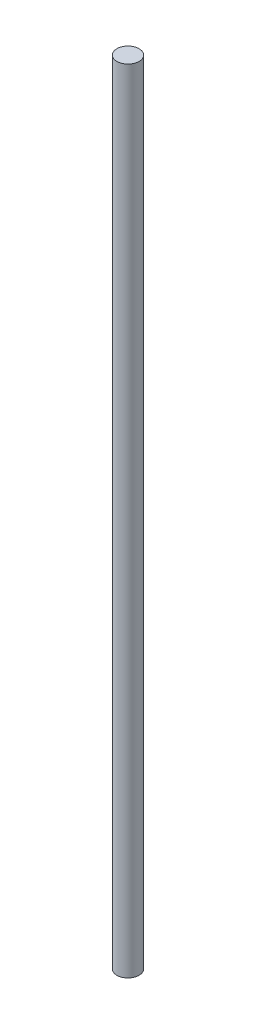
SolidWorks part; units mm, degrees
ref_plane "Alzado" through (0, 0, 0) normal (0, 0, 1) x (1, 0, 0)
ref_plane "Planta" through (0, 0, 0) normal (0, 1, 0) x (1, 0, 0)
ref_plane "Vista lateral" through (0, 0, 0) normal (1, 0, 0) x (0, 0, -1)
sketch "Croquis1" plane through (0, 0, 0) normal (0, 1, 0) x (1, 0, 0)
  circle A0 centre (0, 0) radius 7
  dimension "D1" = 14
extrude "Saliente-Extruir1" add sketch "Croquis1" along normal blind 500
